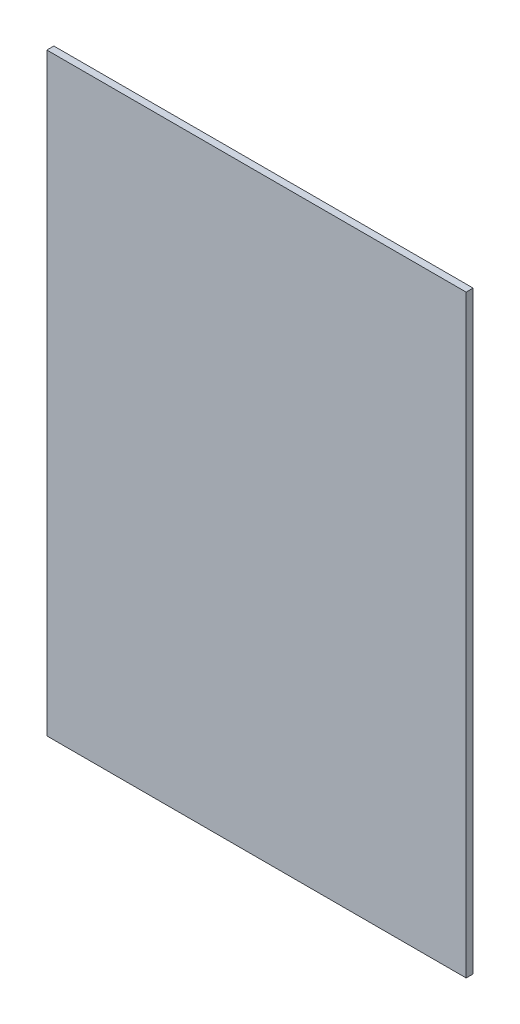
SolidWorks part; units mm, degrees
ref_plane "Front Plane" through (0, 0, 0) normal (0, 0, 1) x (1, 0, 0)
ref_plane "Top Plane" through (0, 0, 0) normal (0, 1, 0) x (1, 0, 0)
ref_plane "Right Plane" through (0, 0, 0) normal (1, 0, 0) x (0, 0, -1)
sketch "Sketch1" plane through (0, 0, 0) normal (0, 0, 1) x (1, 0, 0)
  line L1 (-76.2, 107.95) -> (76.2, 107.95)
  line L2 (-76.2, 107.95) -> (-76.2, -107.95)
  line L3 (-76.2, -107.95) -> (76.2, -107.95)
  line L4 (76.2, 107.95) -> (76.2, -107.95)
  line L5 (-76.2, 107.95) -> (76.2, -107.95) construction
  line L6 (-76.2, -107.95) -> (76.2, 107.95) construction
  point P0 (0, 0)
  dimension "D1" = 152.4
  dimension "D2" = 215.9
extrude "Boss-Extrude1" add sketch "Sketch1" along normal blind 2.54
equation "\"thickness_acrylic0.1\"=0.1in"
equation "\"motor offset\"=6mm"
equation "\"thickness0.25\"=0.225in"
equation "\"thickness0.125\"=0.122in"
